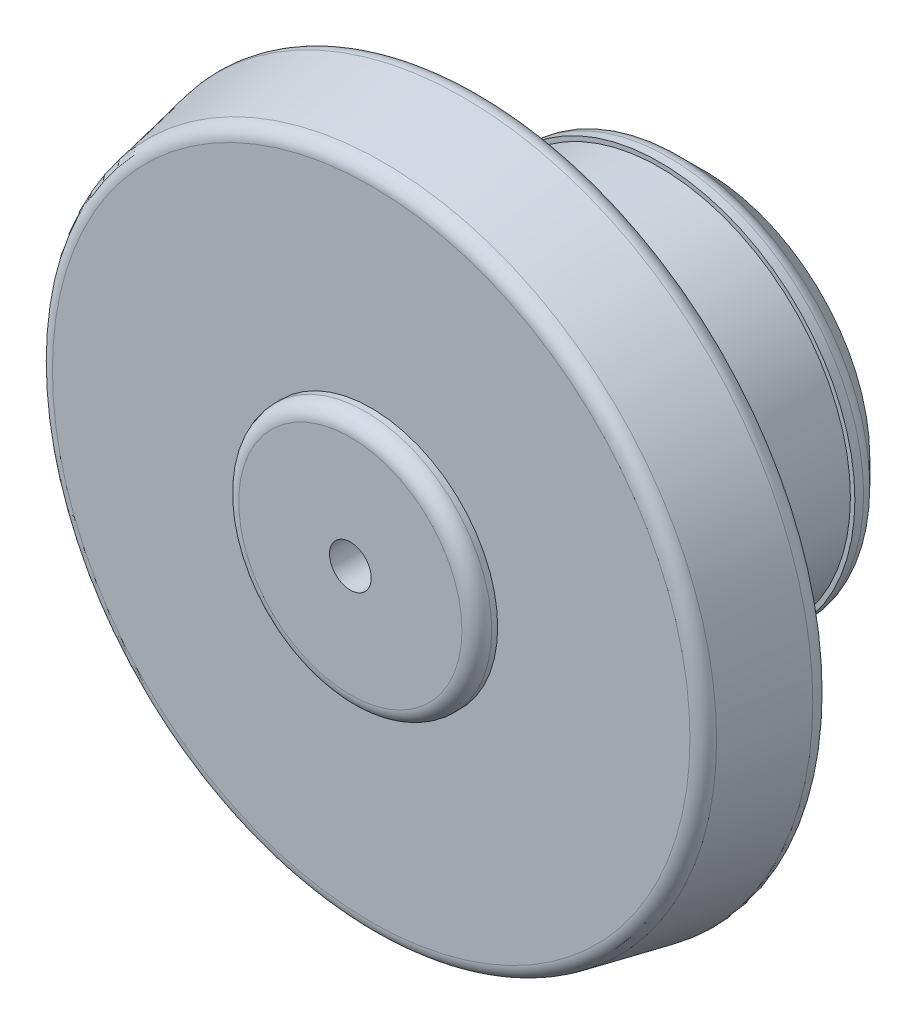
SolidWorks part; units mm, degrees
ref_plane "Plan1" through (0, 0, 0) normal (0, 0, 1) x (1, 0, 0)
ref_plane "Plan2" through (0, 0, 0) normal (0, 1, 0) x (1, 0, 0)
ref_plane "Plan3" through (0, 0, 0) normal (1, 0, 0) x (0, 0, -1)
sketch "Esquisse1" plane through (0, 0, 0) normal (0, 0, 1) x (1, 0, 0)
  circle A0 centre (0, 0) radius 6.55
  dimension "D1" = 13.1
extrude "Extrusion1" add sketch "Esquisse1" along normal blind 1.5
sketch "Esquisse2" plane through (0, 0, 1.5) normal (0, 0, 1) x (1, 0, 0)
  circle A0 centre (0, 0) radius 6.4
  circle A1 centre (0, 0) radius 6.55 construction
  dimension "D1" = 12.8
extrude "Extrusion2" add sketch "Esquisse2" along normal blind 6
chamfer "Chanfrein1" distance 1 angle 45 1 edges at (6.55, 0, 0)
sketch "Esquisse3" plane through (0, 0, 7.5) normal (0, 0, 1) x (1, 0, 0)
  circle A0 centre (0, 0) radius 11.85
  circle A1 centre (0, 0) radius 6.55 construction
  dimension "D1" = 23.7
extrude "Extrusion3" add sketch "Esquisse3" along normal blind 3.7
sketch "Esquisse4" plane through (0, 0, 11.2) normal (0, 0, 1) x (1, 0, 0)
  circle A0 centre (0, 0) radius 4.25
  circle A1 centre (0, 0) radius 11.85 construction
  dimension "D1" = 8.5
extrude "Extrusion4" add sketch "Esquisse4" along normal blind 0.7
sketch "Esquisse6" plane through (0, 0, 0) normal (0, 1, 0) x (1, 0, 0)
  line L0 (-13.2524, -3.7702) -> (-6.4, -3.7702)
  line L1 (-6.4, -3.7702) -> (-6.4, -8.95)
  line L2 (-6.4, -8.95) -> (-9.6, -8.95)
  line L3 (-9.6, -8.95) -> (-9.6, -7.5)
  line L4 (-9.6, -7.5) -> (-11.85, -7.5)
  line L5 (-11.85, -7.5) -> (-11.1211, -11.2)
  line L6 (-11.1211, -11.2) -> (-13.2524, -11.2)
  line L8 (-13.2524, -3.7702) -> (-13.2524, -11.2)
  line L14 (11.85, -7.5) -> (-11.85, -7.5) construction
  line L15 (-6.4, -1.5) -> (-6.4, -7.5) construction
  line L16 (-11.85, -11.2) -> (11.85, -11.2) construction
  dimension "D1" = 3.2
  dimension "D2" = 1.45
ref_axis "Axe1" through (0, 0, -80.9) along (0, 0, 1)
revolve "Enlèvement de matière-Révolution1" cut sketch "Esquisse6" angle 360 about axis through (0, 0, -80.9) along (0, 0, 1)
fillet "Congé1" radius 0.5 4 edges at (4.25, 0, 11.9) (-11.1211, 0, 11.2) (-11.85, 0, 7.5) (6.55, 0, 1)
sketch "Esquisse8" plane through (0, 0, 0) normal (0, 0, -1) x (-1, 0, 0)
  circle A0 centre (0, 0) radius 5
  dimension "D1" = 10
extrude "Enlèv. mat.-Extru.2" cut sketch "Esquisse8" against normal blind 7
sketch "Esquisse9" plane through (0, 0, 7) normal (0, 0, -1) x (-1, 0, 0)
  circle A0 centre (0, 0) radius 2
  circle A1 centre (0, 0) radius 5.55 construction
  dimension "D1" = 4
extrude "Extrusion5" add sketch "Esquisse9" along normal blind 6
sketch "Esquisse7" plane through (0, 0, 0) normal (0, 0, -1) x (-1, 0, 0)
  circle A0 centre (0, 0) radius 0.7
  circle A1 centre (0, 0) radius 5.55 construction
  dimension "D1" = 1.4
extrude "Enlèv. mat.-Extru.1" cut sketch "Esquisse7" against normal through all
sketch "Esquisse10" plane through (0, 0, 0) normal (0, 1, 0) x (1, 0, 0)
  line L0 (1.7362, -1.6601) -> (5.1715, -1.6601)
  line L1 (5.1715, -1.6601) -> (5.1715, -7.0353)
  line L2 (5.1715, -7.0353) -> (1.7362, -7.0353)
  line L3 (1.7362, -7.0353) -> (1.7362, -1.6601)
extrude "Extrusion6" add sketch "Esquisse10" along normal mid plane 0.3
pattern_circular "Répétition circulaire1" count 4 over 360 about axis through (0, 0, 0) along (0, 0, 1) of "Extrusion6"
